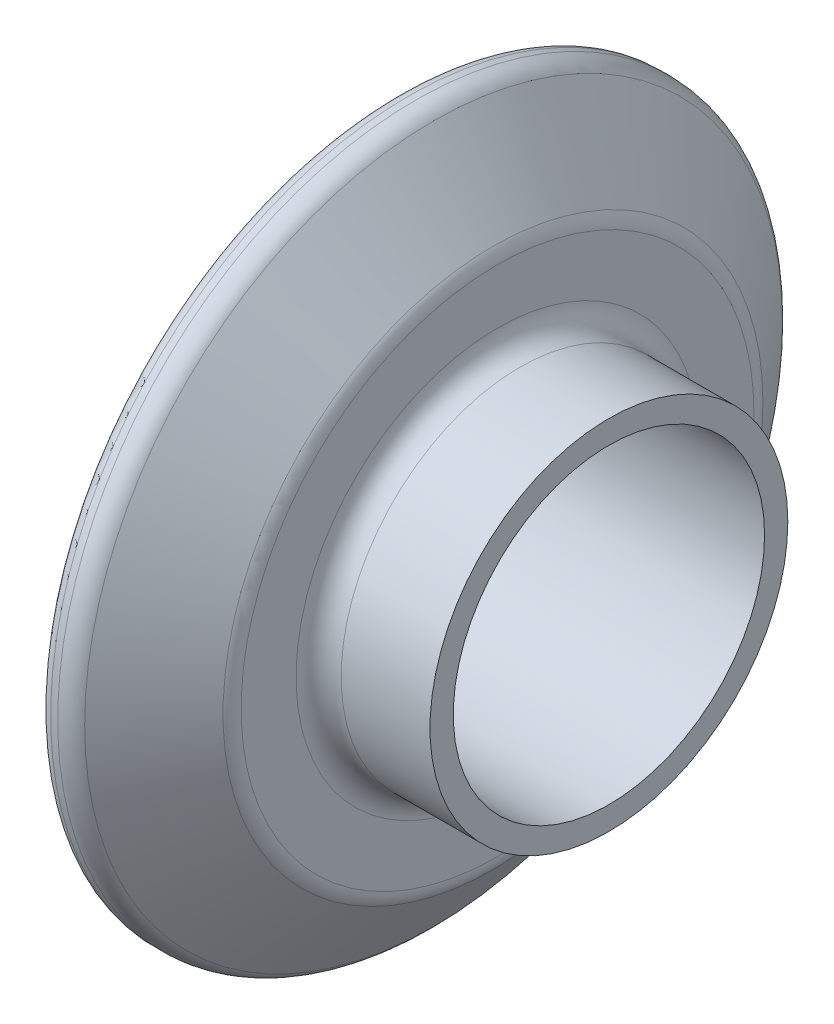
SolidWorks part; units mm, degrees
ref_plane "Front Plane" through (0, 0, 0) normal (0, 0, 1) x (1, 0, 0)
ref_plane "Top Plane" through (0, 0, 0) normal (0, 1, 0) x (1, 0, 0)
ref_plane "Right Plane" through (0, 0, 0) normal (1, 0, 0) x (0, 0, -1)
sketch "Sketch1" plane through (0, 0, 0) normal (0, 0, 1) x (1, 0, 0)
  line L0 (-3.2618, 11.049) -> (-23.2516, 11.049)
  line L1 (-23.2516, 11.049) -> (-23.2516, 14.9098)
  line L2 (-22.4388, 15.7226) -> (-19.1114, 15.7226)
  line L3 (-18.2986, 16.5354) -> (-18.2986, 24.5872)
  line L4 (-17.4858, 25.4) -> (-16.9882, 25.4)
  line L5 (-15.7102, 24.7628) -> (-11.4905, 19.163)
  line L6 (-11.1683, 14.3002) -> (-11.1683, 18.2)
  line L7 (-9.5681, 12.7) -> (-3.2618, 12.7)
  line L8 (-3.2618, 12.7) -> (-3.2618, 11.049)
  line L9 (0, 0) -> (-27.9762, 0) construction
  arc A0 (-17.4858, 25.4) -> (-18.2986, 24.5872) centre (-17.4858, 24.5872) ccw
  arc A1 (-18.2986, 16.5354) -> (-19.1114, 15.7226) centre (-19.1114, 16.5354) cw
  arc A2 (-22.4388, 15.7226) -> (-23.2516, 14.9098) centre (-22.4388, 14.9098) ccw
  arc A4 (-9.5681, 12.7) -> (-11.1683, 14.3002) centre (-9.5681, 14.3002) cw
  arc A5 (-15.7102, 24.7628) -> (-16.9882, 25.4) centre (-16.9882, 23.7998) ccw
  arc A6 (-11.1683, 18.2) -> (-11.4905, 19.163) centre (-12.7685, 18.2) ccw
  point P11 (-18.2986, 25.4)
  point P17 (-23.2516, 15.7226)
  point P25 (-16.1904, 25.4)
  dimension "D4" = 0.8128
  dimension "D1" = 4.953
  dimension "D2" = 37
  dimension "D3" = 19.9898
  dimension "D5" = 11.049
  dimension "D6" = 12.7
  dimension "D7" = 25.4
  dimension "D8" = 15.7226
revolve "Revolve1" add sketch "Sketch1" angle 360 about L9
